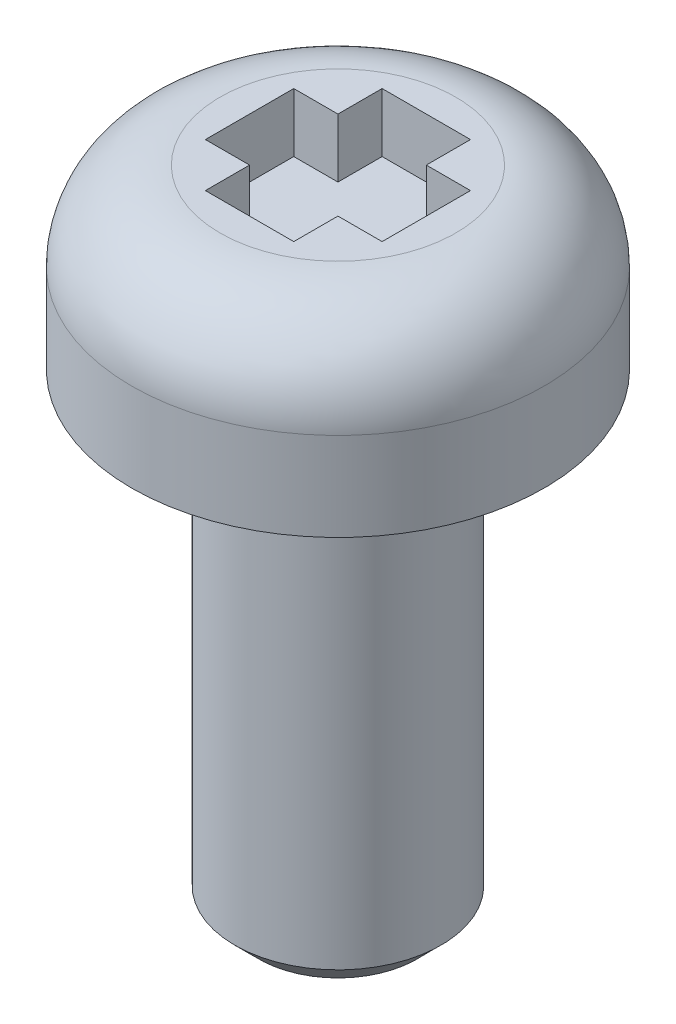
SolidWorks part; units mm, degrees
ref_plane "前视基准面" through (0, 0, 0) normal (0, 0, 1) x (1, 0, 0)
ref_plane "上视基准面" through (0, 0, 0) normal (0, 1, 0) x (1, 0, 0)
ref_plane "右视基准面" through (0, 0, 0) normal (1, 0, 0) x (0, 0, -1)
mirrored part "自攻螺钉M3.5,PH, PT-Type_Mirrored"
other "<自攻螺钉M3.5,PH, PT-Type>-<Chamfer1>"
